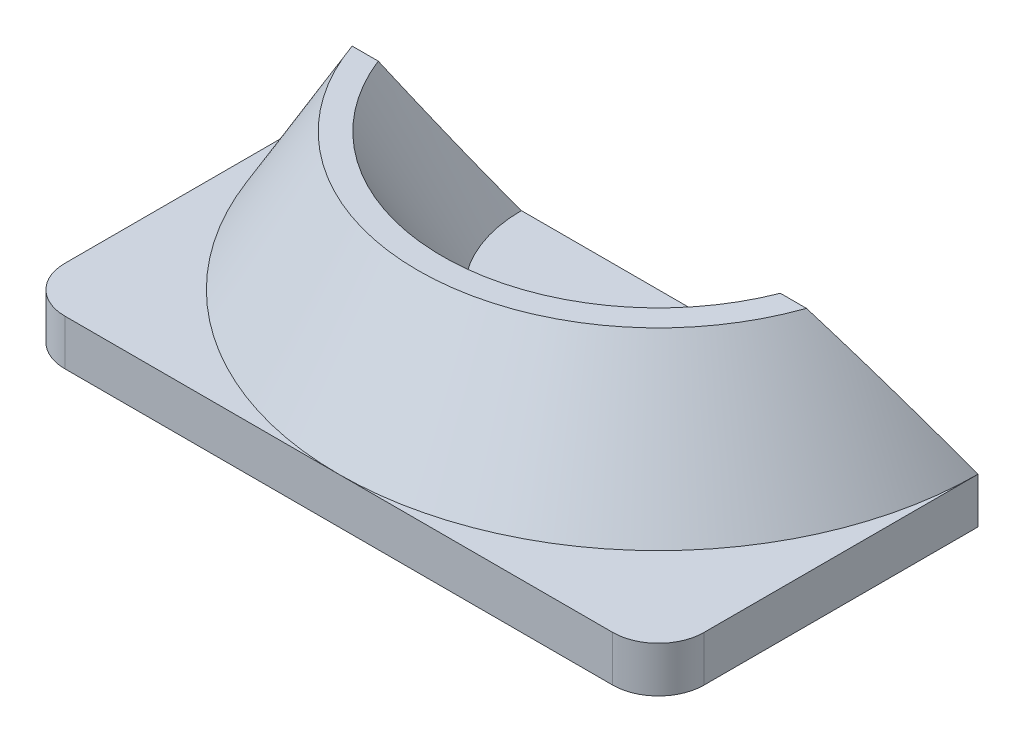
SolidWorks part; units mm, degrees
ref_plane "Front Plane" through (0, 0, 0) normal (0, 0, 1) x (1, 0, 0)
ref_plane "Top Plane" through (0, 0, 0) normal (0, 1, 0) x (1, 0, 0)
ref_plane "Right Plane" through (0, 0, 0) normal (1, 0, 0) x (0, 0, -1)
sketch "Sketch1" plane through (0, 0, 0) normal (0, 1, 0) x (1, 0, 0)
  line L1 (-35, 0) -> (35, 0)
  line L4 (-35, -30) -> (-35, 0)
  line L5 (-30, -35) -> (30, -35)
  line L6 (35, -30) -> (35, 0)
  arc A0 (-35, -30) -> (-30, -35) centre (-30, -30) ccw
  arc A1 (30, -35) -> (35, -30) centre (30, -30) ccw
  point P3 (-35, -35)
  dimension "D1" = 70
  dimension "D2" = 5
  dimension "D3" = 35
extrude "Extrude1" add sketch "Sketch1" along normal blind 5
sketch "Sketch2" plane through (0, 5, 0) normal (0, 1, 0) x (-1, 0, 0)
  line L0 (35, 0) -> (15, 0)
  line L2 (-35, 0) -> (-15, 0)
  line L4 (-35, 0) -> (35, 0) construction
  line L5 (30, 35) -> (-30, 35) construction
  arc A0 (23, 0) -> (-23, 0) centre (0, 0) ccw construction
  arc A1 (35, 0) -> (-35, 0) centre (0, 0) ccw
  arc A2 (15, 0) -> (-15, 0) centre (0, 0) ccw
  dimension "D1" = 12
  dimension "D2" = 8
extrude "Extrude2" add sketch "Sketch2" along normal blind 15 draft 30
